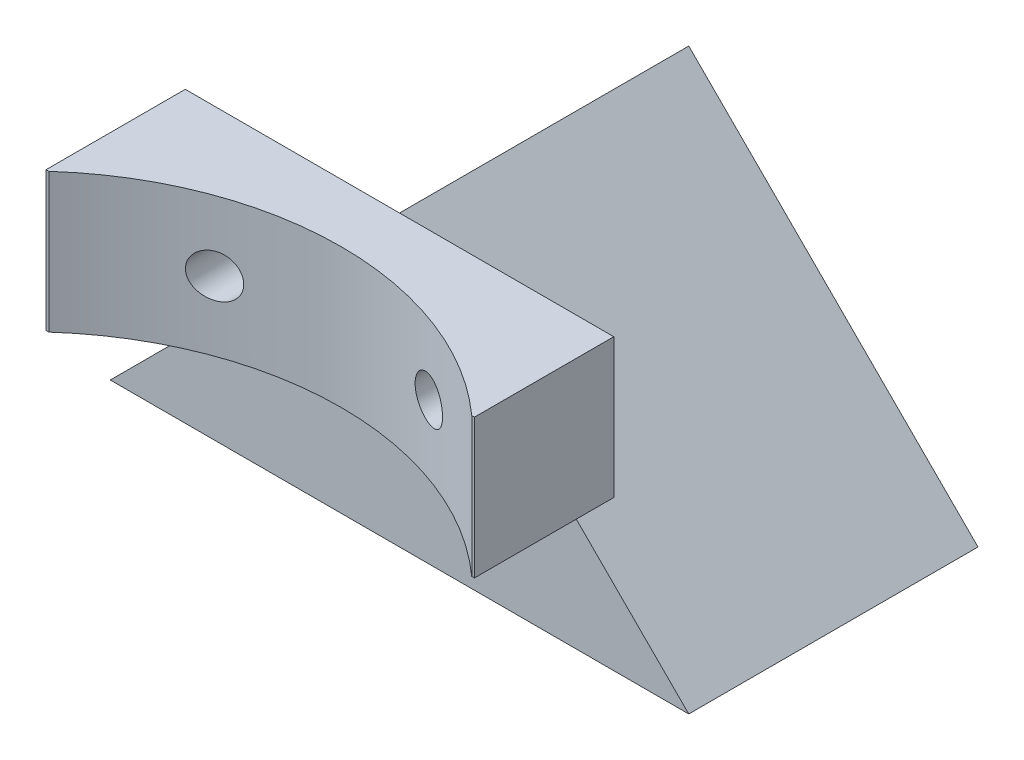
SolidWorks part; units mm, degrees
ref_plane "Plan de face" through (0, 0, 0) normal (0, 0, 1) x (1, 0, 0)
ref_plane "Plan de dessus" through (0, 0, 0) normal (0, 1, 0) x (1, 0, 0)
ref_plane "Plan de droite" through (0, 0, 0) normal (1, 0, 0) x (0, 0, -1)
sketch "Esquisse1" plane through (0, 0, 0) normal (0, 0, 1) x (1, 0, 0)
  line L1 (-30.7773, 17.7336) -> (23.2227, 17.7336)
  line L2 (-30.7773, 17.7336) -> (-30.7773, -9.2664)
  line L3 (-30.7773, -9.2664) -> (23.2227, -9.2664)
  line L4 (23.2227, 17.7336) -> (23.2227, -9.2664)
  dimension "D1" = 54
  dimension "D2" = 27
extrude "Boss.-Extru.1" add sketch "Esquisse1" along normal blind 27
sketch "Esquisse2" plane through (0, 0, 0) normal (0, 0, -1) x (-1, 0, 0)
  line L0 (-23.2227, -9.2664) -> (3.7773, 17.7336)
  line L1 (-23.2227, 17.7336) -> (30.7773, 17.7336) construction
  line L2 (3.7773, 17.7336) -> (-23.2227, 17.7336)
  line L3 (-23.2227, 17.7336) -> (-23.2227, -9.2664)
extrude "Enlèv. mat.-Extru.1" cut sketch "Esquisse2" against normal blind 27
sketch "Esquisse3" plane through (0, 0, 0) normal (0, 0, -1) x (-1, 0, 0)
  line L0 (30.7773, -9.2664) -> (3.7773, 17.7336)
  line L1 (3.7773, 17.7336) -> (30.7773, 17.7336)
  line L2 (30.7773, 17.7336) -> (30.7773, -9.2664)
extrude "Enlèv. mat.-Extru.2" cut sketch "Esquisse3" against normal blind 27
sketch "Esquisse4" plane through (0, 0, 27) normal (0, 0, 1) x (1, 0, 0)
  line L1 (-23.7773, 17.7336) -> (16.2227, 17.7336)
  line L2 (-23.7773, 17.7336) -> (-23.7773, 4.7336)
  line L3 (-23.7773, 4.7336) -> (16.2227, 4.7336)
  line L4 (16.2227, 17.7336) -> (16.2227, 4.7336)
  dimension "D1" = 40
  dimension "D2" = 13
  dimension "D3" = 7
  dimension "D4" = 0
extrude "Boss.-Extru.3" add sketch "Esquisse4" along normal blind 13
sketch "Esquisse5" plane through (0, 0, 40) normal (0, 0, 1) x (1, 0, 0)
  line L3 (16.2227, 4.7336) -> (16.2227, 17.7336) construction
  line L5 (16.2227, 17.7336) -> (-23.7773, 17.7336) construction
  circle A0 centre (6.2227, 11.2336) radius 2
  circle A1 centre (-13.7773, 11.2336) radius 2
  dimension "D2" = 4
  dimension "D3" = 4
  dimension "D1" = 20
  dimension "D4" = 10
  dimension "D5" = 6.5
  dimension "D6" = 6.5
extrude "Enlèv. mat.-Extru.3" cut sketch "Esquisse5" against normal blind 13
sketch "Esquisse6" plane through (0, 17.7336, 0) normal (0, 1, 0) x (1, 0, 0)
  circle A0 centre (-3.7773, -62) radius 29.56
  dimension "D1" = 59.12
  dimension "D2" = 35
  dimension "D3" = 20
extrude "Enlèv. mat.-Extru.16" cut sketch "Esquisse6" against normal blind 21
